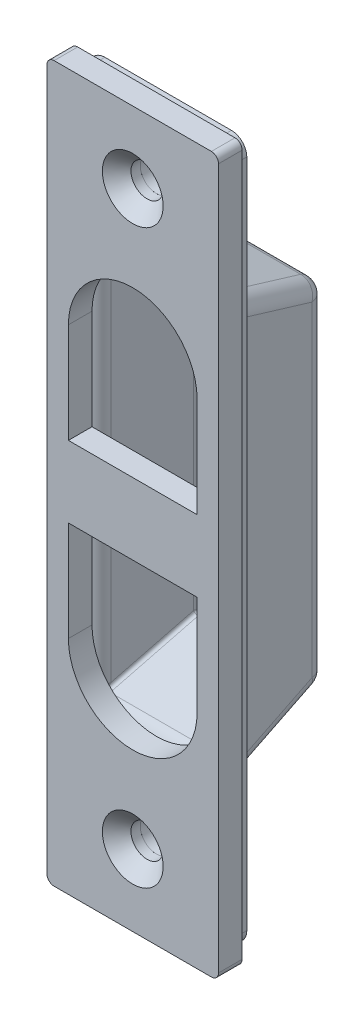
SolidWorks part; units mm, degrees
ref_plane "Front Plane" through (0, 0, 0) normal (0, 0, 1) x (1, 0, 0)
ref_plane "Top Plane" through (0, 0, 0) normal (0, 1, 0) x (1, 0, 0)
ref_plane "Right Plane" through (0, 0, 0) normal (1, 0, 0) x (0, 0, -1)
sketch "Sketch1" [suppressed] plane through (0, 0, 0) normal (1, 0, 0) x (0, 0, -1)
  line L0 (0, 0) -> (-61.7524, 0) construction
  line L1 (0, 34.5) -> (0, -34.5)
  line L2 (1.65, -17) -> (15.312, -15.3225)
  line L3 (17.2, -13.1885) -> (17.2, -5.8856)
  line L4 (16.8112, -4.6524) -> (1.65, 17)
  line L5 (0, 34.5) -> (1.65, 34.5)
  line L6 (1.65, 34.5) -> (1.65, 17)
  line L7 (0, -34.5) -> (1.65, -34.5)
  line L8 (1.65, -34.5) -> (1.65, -17)
  arc A0 (15.312, -15.3225) -> (17.2, -13.1885) centre (15.05, -13.1885) ccw
  arc A1 (17.2, -5.8856) -> (16.8112, -4.6524) centre (15.05, -5.8856) ccw
  point P17 (1.65, 17)
  point P20 (1.65, -17)
  dimension "D7" = 2.15
  dimension "D1" = 17.2
  dimension "D2" = 69
  dimension "D3" = 1.65
  dimension "D4" = 34
  dimension "D5" = 7
  dimension "D6" = 35
extrude "Extrude1" [suppressed] add sketch "Sketch1" along normal mid plane 22 separate body
sketch "Sketch3" [suppressed] plane through (0, 0, 0) normal (0, 1, 0) x (1, 0, 0)
  line L0 (11, 1.65) -> (-11, 1.65) construction
  line L1 (-10, 1.65) -> (-12.5, 1.65)
  line L2 (-10, 1.65) -> (-8.9126, 17.2)
  line L3 (-8.9126, 17.2) -> (-12.5, 17.2)
  line L4 (-12.5, 1.65) -> (-12.5, 17.2)
  line L5 (11, 1.65) -> (-11, 1.65) construction
  line L6 (10, 1.65) -> (12.5, 1.65)
  line L7 (10, 1.65) -> (8.9126, 17.2)
  line L8 (8.9126, 17.2) -> (12.5, 17.2)
  line L9 (12.5, 1.65) -> (12.5, 17.2)
  line L10 (0, 0) -> (0, 20.7966) construction
  line L11 (11, 17.2) -> (-11, 17.2) construction
  dimension "D1" = 4
  dimension "D2" = 20
  dimension "D3" = 25
extrude "Extrude2" [suppressed] cut sketch "Sketch3" against normal through all and the other way through all
fillet "Fillet1" [suppressed] radius 0.5
fillet "Fillet2" [suppressed] radius 2.15
shell "Shell1" [suppressed] thickness 1.65
sketch "Sketch8" [suppressed] plane through (0, 0, 0) normal (0, 0, 1) x (1, 0, 0)
  line L0 (0, 8) -> (0, 4) construction
  line L1 (-11, 35) -> (11, 35)
  line L2 (-12, 34) -> (-12, -34)
  line L3 (-11, -35) -> (11, -35)
  line L4 (12, 34) -> (12, -34)
  line L5 (-12, 35) -> (12, -35) construction
  line L6 (-12, -35) -> (12, 35) construction
  line L7 (9, 8) -> (9, 4)
  line L8 (-9, 8) -> (-9, 4)
  arc A0 (9, 8) -> (-9, 8) centre (0, 8) ccw
  arc A1 (-9, 4) -> (9, 4) centre (0, 4) ccw
  arc A2 (-11, 35) -> (-12, 34) centre (-11, 34) ccw
  arc A3 (11, 35) -> (12, 34) centre (11, 34) cw
  arc A4 (11, -35) -> (12, -34) centre (11, -34) ccw
  arc A5 (-12, -34) -> (-11, -35) centre (-11, -34) ccw
  point P0 (0, 0)
  point P8 (0, 6)
  point P13 (0, 17)
  point P14 (0, -5)
  dimension "D3" = 9
  dimension "D6" = 1
  dimension "D1" = 24
  dimension "D2" = 70
  dimension "D4" = 18
  dimension "D5" = 22
extrude "Extrude5" [suppressed] add sketch "Sketch8" along normal blind 3.3 separate body
sketch "Sketch11" [suppressed] plane through (0, 0, 0) normal (1, 0, 0) x (0, 0, -1)
  line L0 (-7.351, 27) -> (29.1079, 27) construction
  line L1 (-3.3, 27) -> (-3.3, 31.25)
  line L2 (-3.3, 31.25) -> (-1.3, 29.25)
  line L3 (-1.3, 29.25) -> (11.7, 29.25)
  line L4 (11.7, 29.25) -> (11.7, 27)
  line L5 (11.7, 27) -> (-3.3, 27)
  dimension "D1" = 45
  dimension "D2" = 8.5
  dimension "D3" = 4.5
  dimension "D4" = 3.3
  dimension "D5" = 27
  dimension "D6" = 15
revolve "Cut-Revolve2" [suppressed] cut sketch "Sketch11" angle 360 about L0
mirror "Mirror2" [suppressed] about plane through (0, 0, 0) normal (0, 1, 0)
sketch "Sketch5" plane through (0, 0, 0) normal (1, 0, 0) x (0, 0, -1)
  line L0 (0, 0) -> (-18.2965, 0) construction
  line L1 (0, -49) -> (0, 49)
  line L2 (0, 49) -> (1.65, 49)
  line L3 (1.65, 49) -> (1.65, 29)
  line L4 (1.65, 29) -> (14.7, 24.2502)
  line L5 (14.7, 24.2502) -> (14.7, -24.2502)
  line L6 (14.7, -24.2502) -> (1.65, -29)
  line L7 (1.65, -29) -> (1.65, -49)
  line L8 (1.65, -49) -> (0, -49)
  dimension "D1" = 1.65
  dimension "D2" = 98
  dimension "D3" = 58
  dimension "D4" = 14.7
  dimension "D5" = 70
extrude "Extrude3" add sketch "Sketch5" along normal mid plane 22 separate body
sketch "Sketch7" plane through (0, 0, 0) normal (0, 1, 0) x (1, 0, 0)
  line L0 (0, 0) -> (0, 16.399) construction
  line L1 (11, 1.65) -> (-11, 1.65) construction
  line L2 (10, 1.65) -> (12.5, 1.65)
  line L3 (10, 1.65) -> (8.8583, 14.7)
  line L4 (8.8583, 14.7) -> (12.5, 14.7)
  line L5 (12.5, 1.65) -> (12.5, 14.7)
  line L6 (11, 1.65) -> (-11, 1.65) construction
  line L7 (-10, 1.65) -> (-12.5, 1.65)
  line L8 (-10, 1.65) -> (-8.8583, 14.7)
  line L9 (-8.8583, 14.7) -> (-12.5, 14.7)
  line L10 (-12.5, 1.65) -> (-12.5, 14.7)
  line L11 (11, 14.7) -> (-11, 14.7) construction
  dimension "D1" = 25
  dimension "D2" = 20
  dimension "D3" = 5
extrude "Extrude4" cut sketch "Sketch7" against normal mid plane 122
fillet "Fillet3" radius 2.15 6 edges at (11, -49, -0.825) (-11, -49, -0.825) (11, 49, -0.825) (-11, 49, -0.825) (0, -24.2502, -14.7) (0, 24.2502, -14.7)
fillet "Fillet4" radius 2.15 10 edges at (9.491, 26.8825, -7.4677) (8.8923, 23.9779, -14.3112) (8.8583, 0, -14.7) (8.8923, -23.9779, -14.3112) (-9.491, 26.8825, -7.4677) (-8.8923, 23.9779, -14.3112) (-8.8583, 0, -14.7) (-8.8923, -23.9779, -14.3112) (9.491, -26.8825, -7.4677) (-9.491, -26.8825, -7.4677)
fillet "Fillet5" radius 0.5 8 edges at (9.3905, -28.3538, -1.65) (10, 0, -1.65) (9.3905, 28.3538, -1.65) (0, 29, -1.65) (-9.3905, 28.3538, -1.65) (-10, 0, -1.65) (-9.3905, -28.3538, -1.65) (0, -29, -1.65)
shell "Shell2" thickness 1.65
sketch "Sketch9" plane through (0, 0, 0) normal (0, 0, 1) x (1, 0, 0)
  line L0 (0, 19) -> (0, -19) construction
  line L1 (-11, 50) -> (11, 50)
  line L2 (-12, 49) -> (-12, -49)
  line L3 (-11, -50) -> (11, -50)
  line L4 (12, 49) -> (12, -49)
  line L5 (-12, 50) -> (12, -50) construction
  line L6 (-12, -50) -> (12, 50) construction
  line L7 (9, 19) -> (9, 5)
  line L8 (-9, 19) -> (-9, 5)
  line L9 (-9, 5) -> (9, 5)
  line L10 (-9, -5) -> (9, -5)
  line L11 (0, 0) -> (19.628, 0) construction
  line L12 (-9, -5) -> (-9, -19)
  line L13 (9, -5) -> (9, -19)
  arc A0 (-11, 50) -> (-12, 49) centre (-11, 49) ccw
  arc A1 (11, 50) -> (12, 49) centre (11, 49) cw
  arc A2 (11, -50) -> (12, -49) centre (11, -49) ccw
  arc A3 (-12, -49) -> (-11, -50) centre (-11, -49) ccw
  arc A4 (9, 19) -> (-9, 19) centre (0, 19) ccw
  arc A5 (-9, -19) -> (9, -19) centre (0, -19) ccw
  point P0 (0, 0)
  point P20 (0, 0)
  point P31 (0, 28)
  point P32 (0, -28)
  dimension "D3" = 1
  dimension "D4" = 9
  dimension "D1" = 24
  dimension "D2" = 100
  dimension "D5" = 56
  dimension "D6" = 10
extrude "Extrude6" add sketch "Sketch9" along normal blind 3.3 separate body
sketch "Sketch10" plane through (0, 0, 0) normal (1, 0, 0) x (0, 0, -1)
  line L0 (-5.3899, 40) -> (9.7749, 40) construction
  line L1 (-3.3, 40) -> (-3.3, 44.25)
  line L2 (-3.3, 44.25) -> (-1.3, 42.25)
  line L3 (-1.3, 42.25) -> (11.7, 42.25)
  line L4 (11.7, 42.25) -> (11.7, 40)
  line L5 (11.7, 40) -> (-3.3, 40)
  dimension "D1" = 45
  dimension "D2" = 8.5
  dimension "D3" = 4.5
  dimension "D4" = 3.3
  dimension "D5" = 40
  dimension "D6" = 15
revolve "Cut-Revolve1" cut sketch "Sketch10" angle 360 about L0
mirror "Mirror1" about plane through (0, 0, 0) normal (0, 1, 0) of "Cut-Revolve1"
